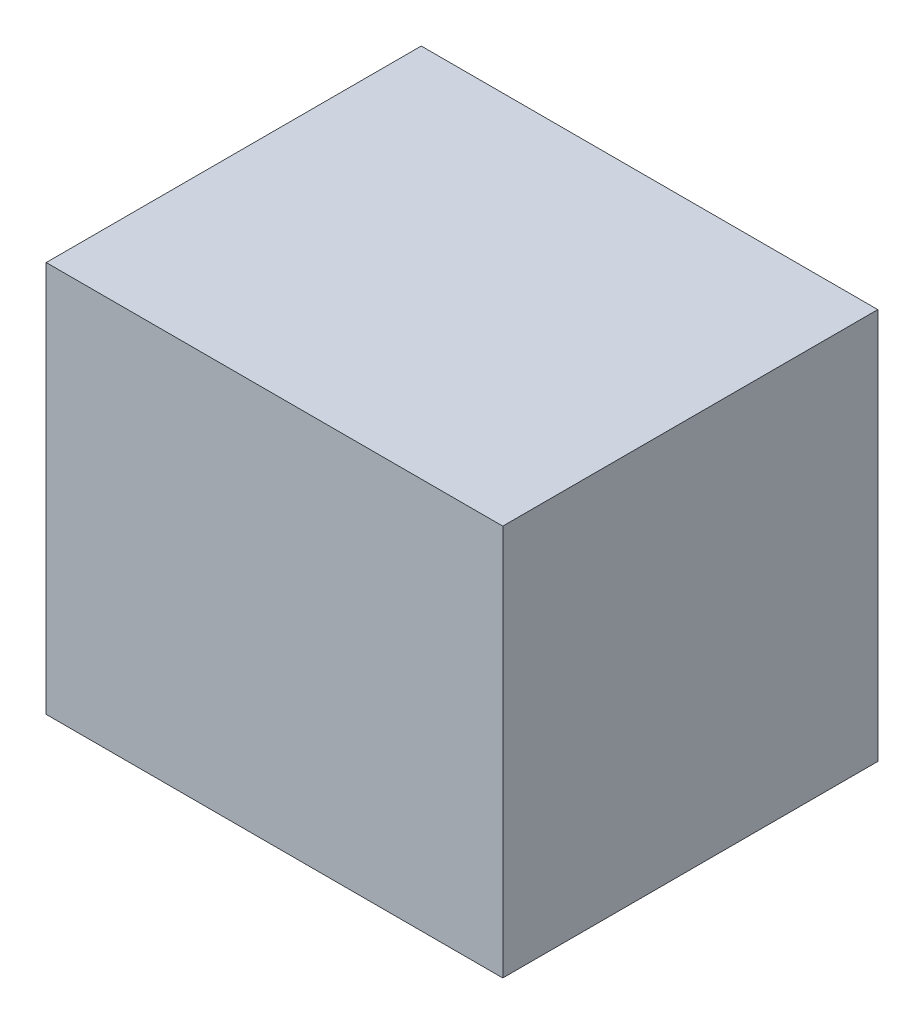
SolidWorks part; units mm, degrees
ref_plane "Plan de face" through (0, 0, 0) normal (0, 0, 1) x (1, 0, 0)
ref_plane "Plan de dessus" through (0, 0, 0) normal (0, 1, 0) x (1, 0, 0)
ref_plane "Plan de droite" through (0, 0, 0) normal (1, 0, 0) x (0, 0, -1)
sketch "Esquisse1" plane through (0, -134.6169, 0) normal (0, 1, 0) x (1, 0, 0)
  line L0 (35.5842, -33.1167) -> (91.5842, -33.1167) construction
  line L1 (35.5842, 12.8833) -> (91.5842, 12.8833)
  line L2 (35.5842, 12.8833) -> (35.5842, -33.1167)
  line L3 (35.5842, -33.1167) -> (91.5842, -33.1167)
  line L4 (91.5842, 12.8833) -> (91.5842, -33.1167)
  line L5 (91.5842, -33.1167) -> (91.5842, 12.8833) construction
extrude "Boss.-Extru.1" add sketch "Esquisse1" along normal blind 48
